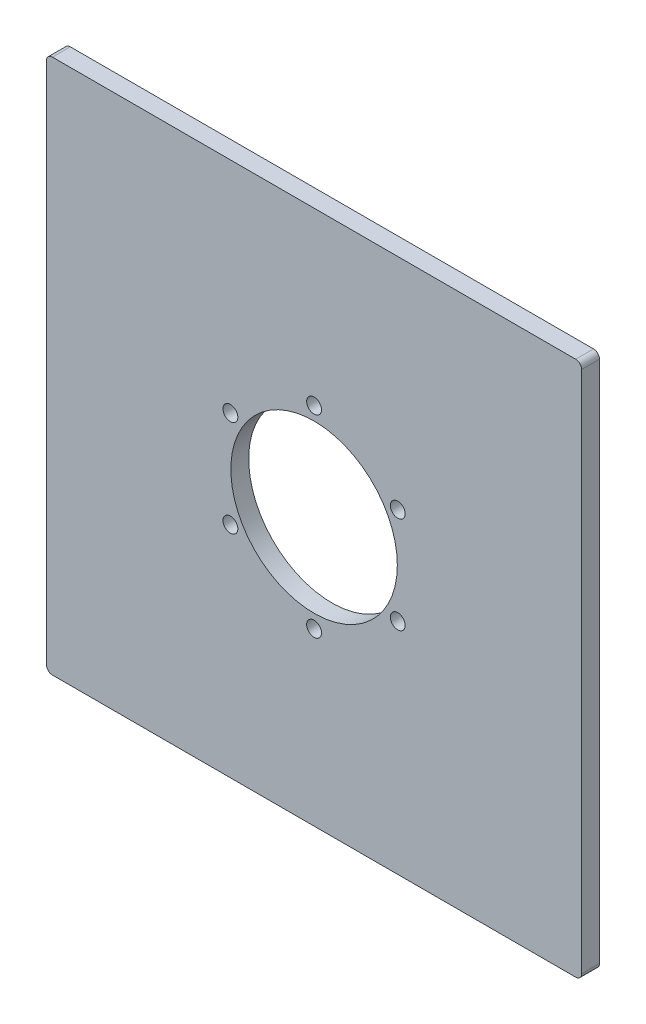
SolidWorks part; units mm, degrees
ref_plane "Front Plane" through (0, 0, 0) normal (0, 0, 1) x (1, 0, 0)
ref_plane "Top Plane" through (0, 0, 0) normal (0, 1, 0) x (1, 0, 0)
ref_plane "Right Plane" through (0, 0, 0) normal (1, 0, 0) x (0, 0, -1)
sketch "Sketch1" plane through (0, 0, 0) normal (0, 0, 1) x (1, 0, 0)
  line L1 (-114.3, -114.3) -> (114.3, -114.3)
  line L2 (-114.3, -114.3) -> (-114.3, 114.3)
  line L3 (-114.3, 114.3) -> (114.3, 114.3)
  line L4 (114.3, -114.3) -> (114.3, 114.3)
  line L5 (-114.3, -114.3) -> (114.3, 114.3) construction
  line L6 (-114.3, 114.3) -> (114.3, -114.3) construction
  point P0 (0, 0)
  dimension "D1" = 228.6
  dimension "D2" = 228.6
extrude "Boss-Extrude1" add sketch "Sketch1" along normal blind 7.62
fillet "Fillet1" radius 2.54 4 edges at (-114.3, -114.3, 3.81) (114.3, -114.3, 3.81) (114.3, 114.3, 3.81) (-114.3, 114.3, 3.81)
sketch "Sketch2" plane through (0, 0, 7.62) normal (0, 0, 1) x (1, 0, 0)
  circle A0 centre (0, 0) radius 35.56
  dimension "D1" = 71.12
extrude "Cut-Extrude1" cut sketch "Sketch2" against normal blind 7.62
sketch "Sketch3" plane through (0, 0, 7.62) normal (0, 0, 1) x (1, 0, 0)
  circle A0 centre (0, 0) radius 41.275 construction
  circle A1 centre (0, 41.275) radius 3.175
  dimension "D1" = 82.55
  dimension "D2" = 6.35
extrude "Cut-Extrude2" cut sketch "Sketch3" against normal blind 7.62
pattern_circular "CirPattern1" count 6 over 360 about axis through (0, 0, 0) along (0, 0, 1) of "Cut-Extrude2"
